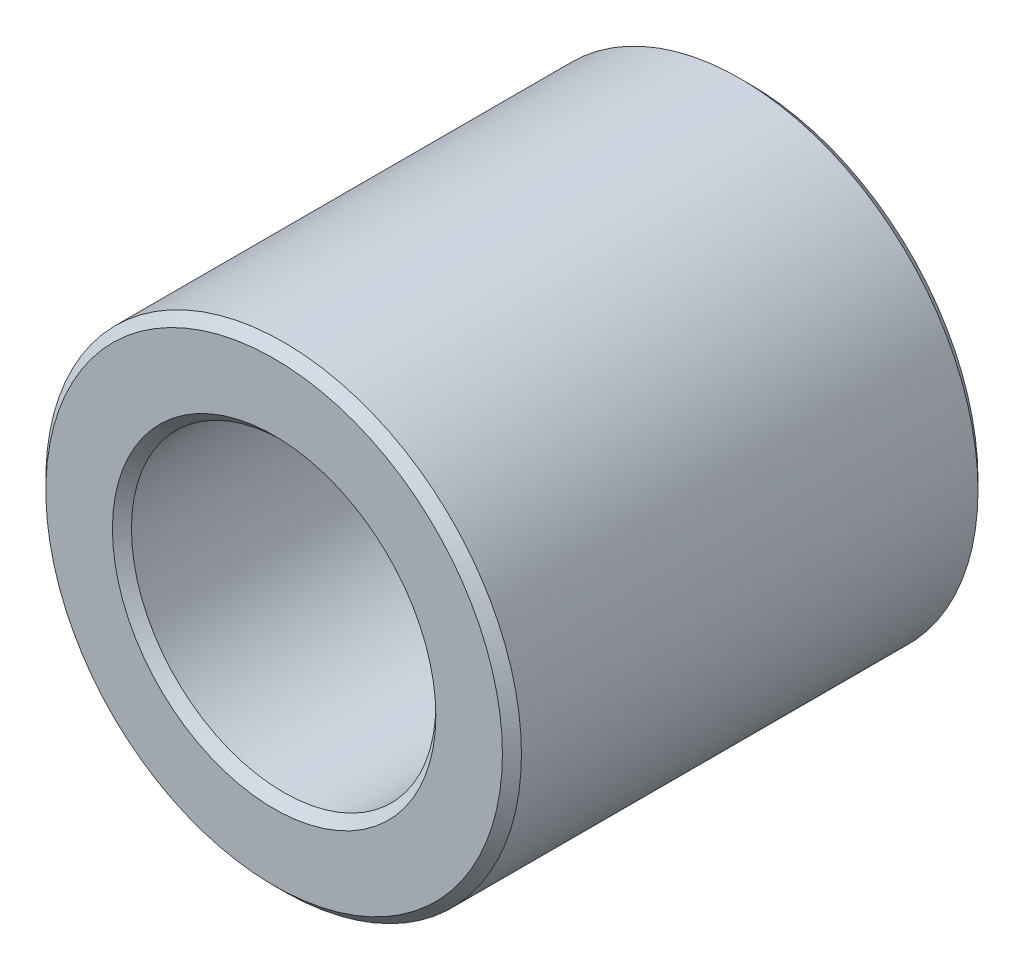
SolidWorks part; units mm, degrees
ref_plane "Front Plane" through (0, 0, 0) normal (0, 0, 1) x (1, 0, 0)
ref_plane "Top Plane" through (0, 0, 0) normal (0, 1, 0) x (1, 0, 0)
ref_plane "Right Plane" through (0, 0, 0) normal (1, 0, 0) x (0, 0, -1)
sketch "Sketch1" plane through (0, 0, 0) normal (0, 0, 1) x (1, 0, 0)
  circle A0 centre (0, 0) radius 5
  circle A1 centre (0, 0) radius 3.2
  dimension "D1" = 10
  dimension "D2" = 6.4
extrude "Boss-Extrude2" add sketch "Sketch1" along normal mid plane 10
chamfer "Chamfer3" distance 0.2 angle 45 4 edges at (5, 0, 5) (5, 0, -5) (3.2, 0, -5) (3.2, 0, 5)
